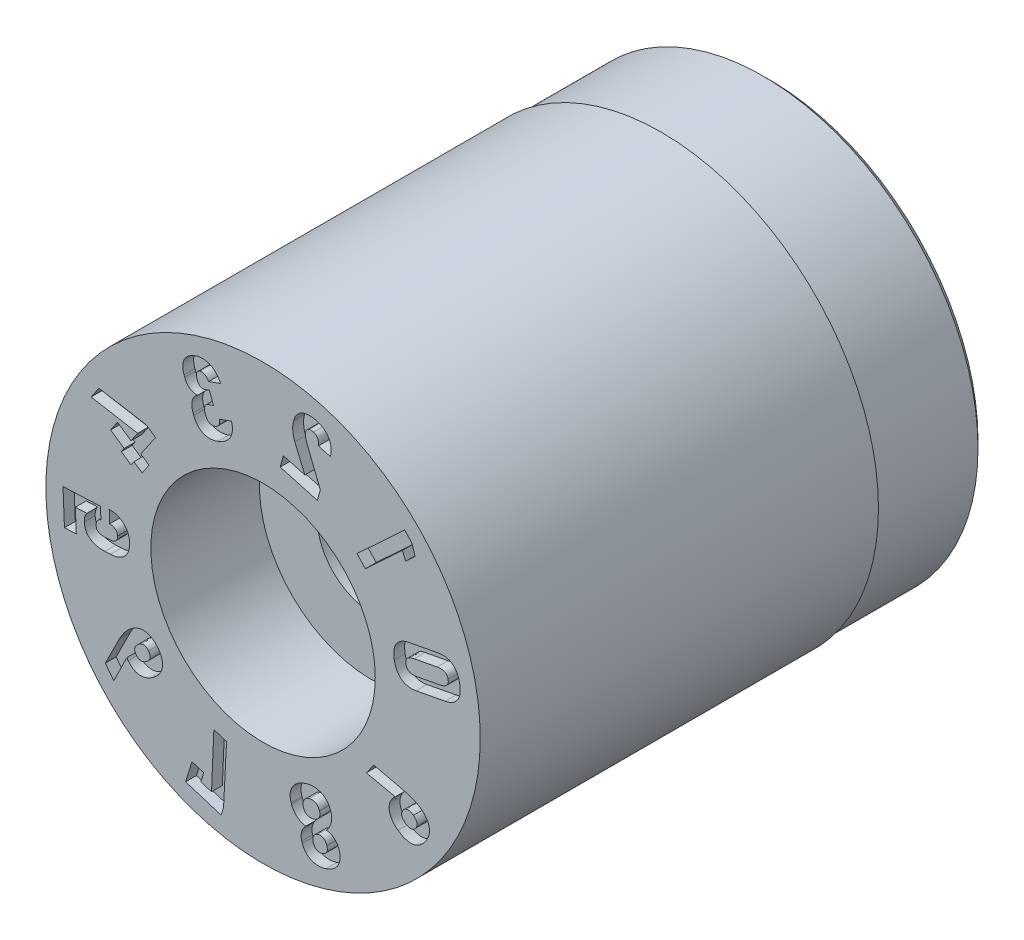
SolidWorks part; units mm, degrees
ref_plane "Front Plane" through (0, 0, 0) normal (0, 0, 1) x (1, 0, 0)
ref_plane "Top Plane" through (0, 0, 0) normal (0, 1, 0) x (1, 0, 0)
ref_plane "Right Plane" through (0, 0, 0) normal (1, 0, 0) x (0, 0, -1)
sketch "Sketch1" plane through (0, 0, 0) normal (1, 0, 0) x (0, 0, -1)
  line L2 (0, 6) -> (0, 3.1)
  line L3 (13.75, 6) -> (0, 6)
  line L4 (-3.7979, 0) -> (49996.2021, 0) construction
  line L8 (14, 1.5) -> (3, 1.5)
  line L9 (3, 3.1) -> (3, 1.5)
  line L10 (3, 3.1) -> (0, 3.1)
  line L12 (14, 1.5) -> (14, 5.75)
  line L16 (14, 5.75) -> (13.75, 6)
  dimension "D1" = 14
  dimension "D2" = 45
  dimension "D3" = 0.25
  dimension "D4" = 12
  dimension "D5" = 6.2
  dimension "D6" = 3
  dimension "D7" = 3
revolve "Revolve1" add sketch "Sketch1" angle 360 about L4
sketch "Sketch4" plane through (0, 0, 0) normal (1, 0, 0) x (0, 0, -1)
  line L0 (0, 0) -> (50000, 0) construction
  line L1 (14, -5.75) -> (14, 5.75) construction
  line L2 (11, 6.935) -> (14, 6.935)
  line L3 (11, 6.935) -> (11, 5.935)
  line L4 (11, 5.935) -> (14, 5.935)
  line L5 (14, 6.935) -> (14, 5.935)
  line L6 (13.75, 6) -> (0, 6) construction
  line L9 (0, 6.6) -> (0, -6.6) construction
  dimension "D1" = 1
  dimension "D2" = 0.065
  dimension "D3" = 11
revolve "Cut-Revolve1" cut sketch "Sketch4" angle 360 about L0
sketch "Sketch5" plane through (0, 0, 0) normal (0, 0, 1) x (1, 0, 0)
  line L0 (4.227, 0.2493) -> (5.0305, 0.4005)
  line L1 (4.8312, 1.4577) -> (4.0277, 1.3065)
  line L2 (4.1758, 0.9894) -> (4.8089, 1.1087)
  line L3 (4.8825, 0.7172) -> (4.2493, 0.5979)
  line L4 (2.5953, 2.7152) -> (2.8257, 2.4673)
  line L5 (2.8257, 2.4673) -> (3.8509, 3.42)
  line L6 (3.8509, 3.42) -> (3.9391, 3.2031)
  line L7 (3.9391, 3.2031) -> (4.2028, 3.4482)
  line L8 (4.2028, 3.4482) -> (4.1089, 3.7273)
  line L9 (4.1089, 3.7273) -> (3.9122, 3.9389)
  line L10 (3.9122, 3.9389) -> (2.5953, 2.7152)
  line L11 (1.5819, 3.7338) -> (1.2041, 4.6814)
  line L12 (1.178, 4.9162) -> (1.1787, 4.9188)
  line L13 (1.529, 4.7595) -> (1.5285, 4.7581)
  line L14 (1.5285, 4.7581) -> (1.8636, 4.665)
  line L15 (1.8636, 4.665) -> (1.864, 4.6664)
  line L16 (0.8452, 5.0216) -> (0.8448, 5.0202)
  line L17 (0.8774, 4.5321) -> (1.1544, 3.8746)
  line L18 (1.1544, 3.8746) -> (0.5618, 4.0392)
  line L19 (0.5618, 4.0392) -> (0.4744, 3.7243)
  line L20 (0.4744, 3.7243) -> (1.5, 3.4392)
  line L21 (1.5, 3.4392) -> (1.5819, 3.7338)
  line L22 (-0.8723, 4.1501) -> (-1.2031, 4.0315)
  line L23 (-1.5828, 3.928) -> (-1.5972, 3.9679)
  line L24 (-1.5146, 4.2257) -> (-1.3704, 4.2773)
  line L25 (-1.3704, 4.2773) -> (-1.4809, 4.5862)
  line L26 (-1.4809, 4.5862) -> (-1.6251, 4.5347)
  line L27 (-1.8151, 4.6643) -> (-1.8256, 4.6932)
  line L28 (-1.5024, 4.7812) -> (-1.1726, 4.8993)
  line L29 (-2.1813, 4.6032) -> (-2.1626, 4.5516)
  line L30 (-1.9324, 3.8202) -> (-1.9141, 3.7683)
  line L31 (-3.2277, 2.885) -> (-4.5347, 3.1049)
  line L32 (-4.5347, 3.1049) -> (-4.7493, 2.7892)
  line L33 (-4.7493, 2.7892) -> (-3.4629, 2.5646)
  line L34 (-3.4629, 2.5646) -> (-3.6463, 2.2946)
  line L35 (-3.9148, 1.8992) -> (-3.6458, 1.7166)
  line L36 (-3.6458, 1.7166) -> (-3.567, 1.8327)
  line L37 (-2.971, 2.7105) -> (-3.2277, 2.885)
  line L38 (-4.0215, 2.5493) -> (-4.2111, 2.27)
  line L39 (-4.2111, 2.27) -> (-3.836, 2.0154)
  line L40 (-3.3384, 1.6776) -> (-3.1489, 1.9569)
  line L41 (-3.1489, 1.9569) -> (-3.3773, 2.112)
  line L42 (-4.2484, 0.3524) -> (-4.2495, 0.3523)
  line L43 (-4.2495, 0.3523) -> (-4.2353, 0.013)
  line L44 (-4.2353, 0.013) -> (-4.2342, 0.0131)
  line L45 (-4.232, -0.3673) -> (-4.3827, -0.3738)
  line L46 (-4.4785, -0.0144) -> (-4.4917, 0.3026)
  line L47 (-4.4917, 0.3026) -> (-5.5264, 0.2595)
  line L48 (-5.5264, 0.2595) -> (-5.486, -0.7074)
  line L49 (-5.486, -0.7074) -> (-5.1592, -0.6938)
  line L50 (-5.1592, -0.6938) -> (-5.1853, -0.0662)
  line L51 (-5.1853, -0.0662) -> (-4.8673, -0.0529)
  line L52 (-4.3685, -0.7127) -> (-4.2178, -0.7062)
  line L53 (-3.6581, -2.2113) -> (-3.659, -2.2122)
  line L54 (-3.9742, -2.6184) -> (-4.3583, -3.3842)
  line L55 (-4.3583, -3.3842) -> (-4.1215, -3.6862)
  line L56 (-4.1215, -3.6862) -> (-3.7618, -2.9518)
  line L58 (-3.0133, -3.0446) -> (-3.0127, -3.044)
  line L59 (-3.2054, -2.7637) -> (-3.2064, -2.7646)
  line L60 (-3.4371, -2.4686) -> (-3.4362, -2.4681)
  line L61 (-1.0913, -5.2035) -> (-1.0082, -3.5818)
  line L62 (-1.0082, -3.5818) -> (-1.3589, -3.4725)
  line L63 (-1.3589, -3.4725) -> (-1.4238, -4.9936)
  line L64 (-1.4238, -4.9936) -> (-1.7188, -4.9018)
  line L65 (-1.7188, -4.9018) -> (-1.638, -4.6434)
  line L66 (-1.638, -4.6434) -> (-1.9616, -4.5426)
  line L67 (-1.9616, -4.5426) -> (-2.1395, -5.1129)
  line L68 (-2.1395, -5.1129) -> (-1.1585, -5.4183)
  line L69 (-1.1585, -5.4183) -> (-1.0913, -5.2035)
  line L70 (0.7762, -4.1555) -> (0.7854, -4.1838)
  line L71 (1.0695, -4.9228) -> (1.0847, -4.9678)
  line L72 (2.1023, -4.6312) -> (2.0871, -4.5862)
  line L73 (1.8742, -3.8236) -> (1.865, -3.7952)
  line L74 (1.557, -3.9496) -> (1.5624, -3.9661)
  line L75 (1.1204, -4.1113) -> (1.1144, -4.0933)
  line L76 (1.7594, -4.6803) -> (1.7649, -4.6968)
  line L77 (1.3941, -4.8183) -> (1.3883, -4.8007)
  line L79 (3.7284, -3.3377) -> (3.7295, -3.3385)
  line L80 (4.3383, -2.4856) -> (4.3377, -2.485)
  line L81 (3.8696, -2.3021) -> (3.0604, -2.1122)
  line L82 (3.0604, -2.1122) -> (2.8514, -2.4016)
  line L83 (2.8514, -2.4016) -> (3.6525, -2.5752)
  line L84 (4.1528, -2.7676) -> (4.1538, -2.7685)
  line L85 (3.9342, -3.0702) -> (3.9332, -3.0694)
  line L86 (-3.6463, 2.2946) -> (-4.0215, 2.5493)
  line L87 (-3.3773, 2.112) -> (-2.971, 2.7105)
  line L88 (-3.836, 2.0154) -> (-3.9148, 1.8992)
  line L89 (-3.567, 1.8327) -> (-3.3384, 1.6776)
  circle A0 centre (0, 0) radius 3.7731 construction
  spline S0 degree 3 poles (3.6255, 0.6832) (3.6329, 0.6425) (3.648, 0.5837) (3.6765, 0.5104) (3.7004, 0.4616) (3.7283, 0.4177) (3.7595, 0.3784) (3.7939, 0.3434) (3.8322, 0.3138) (3.8732, 0.2887) (3.9168, 0.2687) (3.9626, 0.2525) (4.0111, 0.2427) (4.0618, 0.2365) (4.1344, 0.2357) (4.1898, 0.2421) (4.227, 0.2493) knots 0 0 0 0 0.14708 0.214839 0.278938 0.340014 0.399093 0.456868 0.513928 0.570655 0.627181 0.684187 0.742494 0.802536 0.865451 1 1 1 1
  spline S1 degree 3 poles (5.0305, 0.4005) (5.0681, 0.4076) (5.1225, 0.4217) (5.1904, 0.449) (5.2356, 0.473) (5.2768, 0.5006) (5.314, 0.5316) (5.3471, 0.5665) (5.3758, 0.6049) (5.4001, 0.6468) (5.4193, 0.6917) (5.434, 0.7395) (5.4436, 0.7905) (5.4485, 0.8446) (5.4477, 0.923) (5.4403, 0.9829) (5.4327, 1.0234) knots 0 0 0 0 0.135991 0.198957 0.259278 0.317536 0.374793 0.430928 0.487677 0.544842 0.602257 0.660982 0.722058 0.786137 0.853629 1 1 1 1
  spline S2 degree 3 poles (5.4327, 1.0234) (5.4255, 1.0642) (5.41, 1.1227) (5.3824, 1.1962) (5.3582, 1.2448) (5.3308, 1.2888) (5.3, 1.3284) (5.2654, 1.363) (5.2279, 1.3933) (5.1873, 1.4184) (5.1439, 1.4387) (5.0982, 1.4546) (5.0496, 1.4647) (4.9985, 1.4702) (4.925, 1.4722) (4.869, 1.4644) (4.8312, 1.4577) knots 0 0 0 0 0.146861 0.214087 0.27809 0.338994 0.397858 0.455548 0.512086 0.568467 0.62461 0.681531 0.739751 0.800471 0.863458 1 1 1 1
  spline S3 degree 3 poles (4.0277, 1.3065) (3.9901, 1.2992) (3.9355, 1.2856) (3.868, 1.2575) (3.8227, 1.2336) (3.7815, 1.206) (3.7443, 1.175) (3.7112, 1.1402) (3.6825, 1.1017) (3.6582, 1.0599) (3.6389, 1.0149) (3.6246, 0.9668) (3.6148, 0.9158) (3.61, 0.8618) (3.6104, 0.7835) (3.618, 0.7237) (3.6255, 0.6832) knots 0 0 0 0 0.135999 0.198976 0.2593 0.317561 0.374821 0.430959 0.487712 0.54488 0.602298 0.661367 0.722447 0.78653 0.853621 1 1 1 1
  spline S4 degree 3 poles (3.9465, 0.7438) (3.9429, 0.7595) (3.9414, 0.7829) (3.9425, 0.8135) (3.9468, 0.8344) (3.953, 0.8541) (3.9615, 0.8727) (3.9731, 0.8897) (3.992, 0.9112) (4.0218, 0.9351) (4.084, 0.9675) (4.1376, 0.9823) (4.1758, 0.9894) knots 0 0 0 0 0.125716 0.183583 0.23912 0.292225 0.34507 0.398743 0.452722 0.568432 0.69579 1 1 1 1
  spline S5 degree 3 poles (4.8089, 1.1087) (4.8471, 1.1153) (4.9025, 1.1222) (4.9721, 1.1137) (5.0087, 1.1025) (5.0339, 1.0891) (5.0509, 1.0776) (5.0659, 1.0635) (5.0787, 1.0473) (5.0903, 1.0294) (5.1031, 1.0017) (5.1093, 0.9789) (5.1121, 0.963) knots 0 0 0 0 0.30425 0.431921 0.546902 0.601209 0.654314 0.707409 0.761607 0.816243 0.873811 1 1 1 1
  spline S6 degree 3 poles (5.1121, 0.963) (5.1157, 0.9473) (5.1172, 0.9238) (5.1161, 0.8933) (5.1118, 0.8724) (5.1057, 0.8525) (5.0967, 0.8342) (5.0855, 0.8168) (5.0662, 0.7957) (5.0365, 0.7716) (4.9746, 0.7384) (4.9204, 0.7249) (4.8825, 0.7172) knots 0 0 0 0 0.125602 0.183416 0.238903 0.29196 0.345455 0.398296 0.453077 0.568682 0.696043 1 1 1 1
  spline S7 degree 3 poles (4.2493, 0.5979) (4.2113, 0.5905) (4.1558, 0.5846) (4.0862, 0.5929) (4.0495, 0.6041) (4.0245, 0.6175) (4.0074, 0.6289) (3.9929, 0.6433) (3.9798, 0.6593) (3.9684, 0.6773) (3.9555, 0.7051) (3.9494, 0.7279) (3.9465, 0.7438) knots 0 0 0 0 0.30444 0.432146 0.547158 0.60148 0.654599 0.707302 0.760602 0.816192 0.873776 1 1 1 1
  spline S8 degree 3 poles (1.2041, 4.6814) (1.1882, 4.7216) (1.1734, 4.7736) (1.1692, 4.8363) (1.1693, 4.873) (1.1732, 4.8995) (1.178, 4.9162) knots 0 0 0 0 0.541521 0.666579 0.783721 1 1 1 1
  spline S9 degree 3 poles (1.1787, 4.9188) (1.1847, 4.9397) (1.1978, 4.9699) (1.2279, 4.9997) (1.2542, 5.0153) (1.2842, 5.0255) (1.3318, 5.03) (1.3688, 5.0237) (1.3937, 5.0165) knots 0 0 0 0 0.245859 0.357439 0.46891 0.585493 0.709548 1 1 1 1
  spline S10 degree 3 poles (1.3937, 5.0165) (1.4184, 5.0093) (1.4542, 4.9937) (1.4908, 4.9584) (1.5113, 4.927) (1.5263, 4.8912) (1.5363, 4.8346) (1.5346, 4.7899) (1.529, 4.7595) knots 0 0 0 0 0.240985 0.354134 0.468631 0.5874 0.713052 1 1 1 1
  spline S11 degree 3 poles (1.864, 4.6664) (1.8752, 4.7183) (1.8836, 4.7957) (1.8785, 4.8969) (1.8651, 4.9667) (1.8441, 5.0323) (1.8146, 5.0928) (1.7773, 5.148) (1.7318, 5.1971) (1.6795, 5.2408) (1.599, 5.2917) (1.5306, 5.3175) (1.4833, 5.3309) knots 0 0 0 0 0.185674 0.271386 0.354246 0.434158 0.512263 0.589164 0.666877 0.746222 0.827244 1 1 1 1
  spline S12 degree 3 poles (1.4833, 5.3309) (1.4329, 5.3448) (1.358, 5.3603) (1.2595, 5.3627) (1.1922, 5.3567) (1.1296, 5.342) (1.0714, 5.3201) (1.0192, 5.2888) (0.9719, 5.2502) (0.9306, 5.2037) (0.882, 5.1299) (0.8579, 5.066) (0.8452, 5.0216) knots 0 0 0 0 0.194818 0.28296 0.366323 0.445889 0.521879 0.596881 0.671801 0.748279 0.827605 1 1 1 1
  spline S13 degree 3 poles (0.8448, 5.0202) (0.8337, 4.9808) (0.8231, 4.92) (0.818, 4.8373) (0.8202, 4.7743) (0.8273, 4.7117) (0.8421, 4.6296) (0.8618, 4.5704) (0.8774, 4.5321) knots 0 0 0 0 0.246012 0.370926 0.498251 0.625433 0.750687 1 1 1 1
  spline S14 degree 3 poles (-1.2468, 3.4786) (-1.1978, 3.4957) (-1.1283, 3.5284) (-1.0452, 3.5845) (-0.9914, 3.6314) (-0.9454, 3.6834) (-0.9073, 3.7399) (-0.8781, 3.8009) (-0.8572, 3.8656) (-0.8459, 3.9338) (-0.8437, 4.0301) (-0.858, 4.1025) (-0.8723, 4.1501) knots 0 0 0 0 0.181189 0.266469 0.349309 0.42972 0.508169 0.586269 0.664997 0.744856 0.826563 1 1 1 1
  spline S15 degree 3 poles (-1.2031, 4.0315) (-1.1987, 4.0142) (-1.1967, 3.9882) (-1.1973, 3.9543) (-1.2013, 3.9307) (-1.2078, 3.9085) (-1.2172, 3.8879) (-1.2291, 3.8691) (-1.2431, 3.8519) (-1.2595, 3.8363) (-1.2859, 3.8186) (-1.3072, 3.807) (-1.3231, 3.8019) knots 0 0 0 0 0.186458 0.271753 0.355242 0.435515 0.513981 0.590927 0.668033 0.74632 0.827255 1 1 1 1
  spline S16 degree 3 poles (-1.3231, 3.8019) (-1.3504, 3.7924) (-1.3922, 3.7827) (-1.4467, 3.7886) (-1.4828, 3.8011) (-1.5151, 3.8217) (-1.5534, 3.8618) (-1.573, 3.9002) (-1.5828, 3.928) knots 0 0 0 0 0.266172 0.383198 0.497107 0.612379 0.730215 1 1 1 1
  spline S17 degree 3 poles (-1.5972, 3.9679) (-1.6076, 3.9967) (-1.6188, 4.0395) (-1.619, 4.0954) (-1.6121, 4.1314) (-1.5978, 4.1631) (-1.5692, 4.2005) (-1.5367, 4.2173) (-1.5146, 4.2257) knots 0 0 0 0 0.300024 0.427576 0.545016 0.655861 0.765085 1 1 1 1
  spline S18 degree 3 poles (-1.6251, 4.5347) (-1.6434, 4.5279) (-1.6728, 4.5236) (-1.7108, 4.5322) (-1.7366, 4.5466) (-1.7603, 4.5671) (-1.7909, 4.6045) (-1.8061, 4.6396) (-1.8151, 4.6643) knots 0 0 0 0 0.226284 0.333189 0.444788 0.564052 0.694141 1 1 1 1
  spline S19 degree 3 poles (-1.8256, 4.6932) (-1.8335, 4.7167) (-1.843, 4.7518) (-1.841, 4.7978) (-1.8332, 4.8276) (-1.8194, 4.854) (-1.7927, 4.8857) (-1.7636, 4.8998) (-1.7439, 4.9075) knots 0 0 0 0 0.287753 0.411591 0.527861 0.639744 0.752927 1 1 1 1
  spline S20 degree 3 poles (-1.7439, 4.9075) (-1.7301, 4.9125) (-1.7084, 4.9176) (-1.6789, 4.9169) (-1.6569, 4.914) (-1.6352, 4.907) (-1.6138, 4.8981) (-1.5932, 4.8856) (-1.5731, 4.8705) (-1.554, 4.8521) (-1.5284, 4.8237) (-1.5128, 4.7984) (-1.5024, 4.7812) knots 0 0 0 0 0.148721 0.221348 0.296414 0.371996 0.449759 0.529719 0.614659 0.702909 0.796697 1 1 1 1
  spline S21 degree 3 poles (-1.1726, 4.8993) (-1.1948, 4.9467) (-1.2329, 5.0141) (-1.2985, 5.0905) (-1.3507, 5.1391) (-1.4078, 5.1783) (-1.4673, 5.2104) (-1.5304, 5.2323) (-1.5957, 5.2464) (-1.6628, 5.2517) (-1.7548, 5.246) (-1.8229, 5.2303) (-1.8669, 5.2138) knots 0 0 0 0 0.185937 0.272263 0.356354 0.437912 0.517414 0.595439 0.674146 0.75359 0.833658 1 1 1 1
  spline S22 degree 3 poles (-1.8669, 5.2138) (-1.9027, 5.2012) (-1.9536, 5.1793) (-2.016, 5.1434) (-2.0569, 5.1147) (-2.0935, 5.0833) (-2.1255, 5.0496) (-2.1529, 5.0131) (-2.1757, 4.9745) (-2.1938, 4.9338) (-2.2073, 4.8914) (-2.215, 4.847) (-2.2186, 4.8012) (-2.2168, 4.7539) (-2.2073, 4.6868) (-2.1929, 4.6368) (-2.1813, 4.6032) knots 0 0 0 0 0.145511 0.212086 0.276075 0.337093 0.396693 0.454167 0.511617 0.568277 0.624892 0.682152 0.740565 0.800818 0.863592 1 1 1 1
  spline S23 degree 3 poles (-2.1626, 4.5516) (-2.1493, 4.5144) (-2.1233, 4.4612) (-2.0728, 4.4026) (-2.0303, 4.3655) (-1.9822, 4.3363) (-1.9108, 4.3066) (-1.8523, 4.2979) (-1.8128, 4.2969) knots 0 0 0 0 0.257245 0.378725 0.500357 0.621364 0.74282 1 1 1 1
  spline S24 degree 3 poles (-1.8128, 4.2969) (-1.8309, 4.2853) (-1.8566, 4.266) (-1.886, 4.2358) (-1.9058, 4.2123) (-1.9222, 4.1866) (-1.9367, 4.1596) (-1.9478, 4.1306) (-1.9572, 4.1004) (-1.9635, 4.0687) (-1.9677, 4.0361) (-1.9683, 4.0022) (-1.9669, 3.9676) (-1.9624, 3.932) (-1.9527, 3.8822) (-1.9414, 3.845) (-1.9324, 3.8202) knots 0 0 0 0 0.120839 0.17875 0.236021 0.292822 0.349349 0.407341 0.466659 0.526612 0.588188 0.650868 0.71599 0.78255 0.851867 1 1 1 1
  spline S25 degree 3 poles (-1.9141, 3.7683) (-1.8971, 3.7225) (-1.8672, 3.6569) (-1.8117, 3.5818) (-1.766, 3.5354) (-1.7155, 3.4968) (-1.6599, 3.4673) (-1.5998, 3.4468) (-1.5356, 3.4352) (-1.4677, 3.4325) (-1.3694, 3.4407) (-1.296, 3.4616) (-1.2468, 3.4786) knots 0 0 0 0 0.177849 0.259155 0.337577 0.413781 0.488775 0.564884 0.643293 0.724994 0.81079 1 1 1 1
  spline S26 degree 3 poles (-3.6876, -0.1525) (-3.6897, -0.1064) (-3.6993, -0.0378) (-3.7307, 0.0473) (-3.7608, 0.1063) (-3.7988, 0.16) (-3.844, 0.2081) (-3.8967, 0.2496) (-3.9556, 0.2855) (-4.0212, 0.3137) (-4.1181, 0.343) (-4.1957, 0.3507) (-4.2484, 0.3524) knots 0 0 0 0 0.165245 0.244424 0.322863 0.400913 0.478529 0.557552 0.63942 0.724147 0.811331 1 1 1 1
  spline S27 degree 3 poles (-4.2342, 0.0131) (-4.204, 0.0113) (-4.1605, 0.0041) (-4.1086, -0.0182) (-4.0769, -0.0398) (-4.0511, -0.0663) (-4.025, -0.1086) (-4.0176, -0.146) (-4.0166, -0.1711) knots 0 0 0 0 0.286677 0.413247 0.532744 0.64808 0.761103 1 1 1 1
  spline S28 degree 3 poles (-4.0166, -0.1711) (-4.0162, -0.1977) (-4.0192, -0.2383) (-4.0438, -0.2843) (-4.0685, -0.3131) (-4.1004, -0.3361) (-4.1544, -0.3594) (-4.2002, -0.3659) (-4.232, -0.3673) knots 0 0 0 0 0.244619 0.356445 0.468733 0.585859 0.710532 1 1 1 1
  spline S29 degree 3 poles (-4.3827, -0.3738) (-4.4143, -0.3749) (-4.4602, -0.3734) (-4.5156, -0.3561) (-4.549, -0.3383) (-4.5757, -0.3147) (-4.6032, -0.2759) (-4.6099, -0.2397) (-4.6114, -0.2159) knots 0 0 0 0 0.303265 0.432107 0.550999 0.662525 0.769301 1 1 1 1
  spline S30 degree 3 poles (-4.6114, -0.2159) (-4.6127, -0.1931) (-4.6095, -0.1594) (-4.5953, -0.1175) (-4.5803, -0.0896) (-4.5606, -0.065) (-4.5288, -0.036) (-4.4991, -0.0216) (-4.4785, -0.0144) knots 0 0 0 0 0.262806 0.385849 0.507006 0.626637 0.74726 1 1 1 1
  spline S31 degree 3 poles (-4.8673, -0.0529) (-4.88, -0.0669) (-4.8954, -0.0918) (-4.9121, -0.1285) (-4.9328, -0.1915) (-4.9395, -0.2477) (-4.9378, -0.2924) knots 0 0 0 0 0.220738 0.342483 0.474 1 1 1 1
  spline S32 degree 3 poles (-4.9378, -0.2924) (-4.9362, -0.3361) (-4.9267, -0.4003) (-4.8954, -0.4786) (-4.8649, -0.5304) (-4.8266, -0.5764) (-4.7807, -0.6156) (-4.7281, -0.6489) (-4.6683, -0.6752) (-4.602, -0.695) (-4.5017, -0.713) (-4.4227, -0.715) (-4.3685, -0.7127) knots 0 0 0 0 0.163691 0.239767 0.314001 0.387834 0.462201 0.538928 0.619759 0.705773 0.797169 1 1 1 1
  spline S33 degree 3 poles (-4.2178, -0.7062) (-4.1636, -0.7039) (-4.0844, -0.6947) (-3.9865, -0.6633) (-3.9221, -0.6333) (-3.8647, -0.5963) (-3.8148, -0.5519) (-3.7731, -0.5004) (-3.7389, -0.4426) (-3.7127, -0.3785) (-3.6888, -0.2818) (-3.6856, -0.2049) (-3.6876, -0.1525) knots 0 0 0 0 0.187028 0.272197 0.353058 0.431044 0.506489 0.581821 0.658218 0.737109 0.819387 1 1 1 1
  spline S34 degree 3 poles (-2.9056, -2.2896) (-2.9376, -2.2491) (-2.9893, -2.1933) (-3.0695, -2.1365) (-3.13, -2.1043) (-3.1926, -2.0819) (-3.2571, -2.0699) (-3.323, -2.0683) (-3.3899, -2.0769) (-3.4575, -2.0954) (-3.5507, -2.1352) (-3.6159, -2.1787) (-3.6581, -2.2113) knots 0 0 0 0 0.180298 0.262844 0.341996 0.418743 0.493946 0.569924 0.647567 0.728532 0.813597 1 1 1 1
  spline S35 degree 3 poles (-3.659, -2.2122) (-3.6853, -2.2332) (-3.7241, -2.267) (-3.772, -2.3174) (-3.8456, -2.4026) (-3.899, -2.4817) (-3.937, -2.5482) knots 0 0 0 0 0.230207 0.350844 0.475765 1 1 1 1
  spline S36 degree 3 poles (-3.937, -2.5482) (-3.9438, -2.5596) (-3.9566, -2.5829) (-3.9688, -2.6064) (-3.9742, -2.6184) knots 0 0 0 0 0.502807 1 1 1 1
  spline S37 degree 3 poles (-3.7618, -2.9518) (-3.7519, -2.9714) (-3.7394, -2.9897) (-3.7262, -3.007) knots 0.759339 0.759339 0.759339 0.759339 1 1 1 1
  spline S38 degree 3 poles (-3.7262, -3.007) (-3.6977, -3.0434) (-3.6504, -3.0928) (-3.577, -3.1423) (-3.5206, -3.1693) (-3.4618, -3.1868) (-3.4009, -3.1947) (-3.3384, -3.1931) (-3.2744, -3.182) (-3.2096, -3.1612) (-3.1188, -3.1203) (-3.0547, -3.0773) (-3.0133, -3.0446) knots 0 0 0 0 0.171399 0.250433 0.326678 0.401893 0.476561 0.552972 0.632426 0.716098 0.804457 1 1 1 1
  spline S39 degree 3 poles (-3.0127, -3.044) (-2.9705, -3.0104) (-2.9121, -2.9569) (-2.8508, -2.8749) (-2.8161, -2.8132) (-2.7913, -2.7497) (-2.7762, -2.6849) (-2.7726, -2.6191) (-2.7789, -2.5527) (-2.7954, -2.486) (-2.8319, -2.3943) (-2.8736, -2.3304) (-2.9056, -2.2896) knots 0 0 0 0 0.187278 0.272314 0.353593 0.431766 0.507592 0.582942 0.659159 0.737967 0.819996 1 1 1 1
  spline S40 degree 3 poles (-3.1624, -2.4914) (-3.1461, -2.5126) (-3.125, -2.5469) (-3.1154, -2.5974) (-3.1169, -2.6336) (-3.1269, -2.669) (-3.1522, -2.7166) (-3.183, -2.7457) (-3.2054, -2.7637) knots 0 0 0 0 0.258674 0.374449 0.487863 0.602639 0.723306 1 1 1 1
  spline S41 degree 3 poles (-3.2064, -2.7646) (-3.2327, -2.7845) (-3.2727, -2.8116) (-3.331, -2.8293) (-3.371, -2.8337) (-3.4093, -2.8287) (-3.4583, -2.8092) (-3.488, -2.7811) (-3.5047, -2.7599) knots 0 0 0 0 0.294267 0.420156 0.537435 0.648669 0.759224 1 1 1 1
  spline S42 degree 3 poles (-3.5047, -2.7599) (-3.5219, -2.7389) (-3.5406, -2.7029) (-3.5481, -2.6508) (-3.5434, -2.6123) (-3.5294, -2.5742) (-3.4981, -2.5219) (-3.4627, -2.4892) (-3.4371, -2.4686) knots 0 0 0 0 0.240463 0.349973 0.462516 0.580198 0.707082 1 1 1 1
  spline S43 degree 3 poles (-3.4362, -2.4681) (-3.4134, -2.4506) (-3.3778, -2.428) (-3.3258, -2.4143) (-3.2892, -2.4133) (-3.2537, -2.4203) (-3.2073, -2.4421) (-3.1791, -2.4705) (-3.1624, -2.4914) knots 0 0 0 0 0.277302 0.39705 0.512682 0.625485 0.741527 1 1 1 1
  spline S44 degree 3 poles (1.1628, -3.4985) (1.1115, -3.5157) (1.0381, -3.5468) (0.9512, -3.6035) (0.8957, -3.6508) (0.8477, -3.7025) (0.8091, -3.7588) (0.7793, -3.8188) (0.7594, -3.8823) (0.7481, -3.9485) (0.747, -4.0411) (0.7612, -4.1104) (0.7762, -4.1555) knots 0 0 0 0 0.189267 0.277092 0.361956 0.443821 0.522942 0.599835 0.677345 0.755081 0.833779 1 1 1 1
  spline S45 degree 3 poles (0.7854, -4.1838) (0.7992, -4.2261) (0.8295, -4.2862) (0.8854, -4.3568) (0.9357, -4.4036) (0.9913, -4.444) (1.0717, -4.4867) (1.1375, -4.5055) (1.1824, -4.5113) knots 0 0 0 0 0.245704 0.369763 0.497088 0.625016 0.749576 1 1 1 1
  spline S46 degree 3 poles (1.1824, -4.5113) (1.1547, -4.5381) (1.1181, -4.5835) (1.0838, -4.6523) (1.0651, -4.7063) (1.0537, -4.7615) (1.049, -4.8346) (1.0584, -4.8887) (1.0695, -4.9228) knots 0 0 0 0 0.257544 0.384667 0.512219 0.638321 0.760057 1 1 1 1
  spline S47 degree 3 poles (1.0847, -4.9678) (1.0993, -5.01) (1.126, -5.0715) (1.1798, -5.1406) (1.225, -5.185) (1.2758, -5.2222) (1.3321, -5.2505) (1.3925, -5.2722) (1.4575, -5.2843) (1.5256, -5.2894) (1.6223, -5.2831) (1.6946, -5.2664) (1.7425, -5.2504) knots 0 0 0 0 0.166991 0.24621 0.324565 0.402312 0.479469 0.558504 0.640353 0.724932 0.812049 1 1 1 1
  spline S48 degree 3 poles (1.7425, -5.2504) (1.7905, -5.2346) (1.8588, -5.2051) (1.9401, -5.1521) (1.992, -5.1075) (2.0366, -5.0587) (2.0724, -5.0057) (2.1003, -4.9492) (2.119, -4.8892) (2.1291, -4.8267) (2.1298, -4.7393) (2.1163, -4.6738) (2.1023, -4.6312) knots 0 0 0 0 0.187873 0.275417 0.360294 0.441981 0.520587 0.597953 0.675533 0.753757 0.832693 1 1 1 1
  spline S49 degree 3 poles (2.0871, -4.5862) (2.0753, -4.5518) (2.0509, -4.5018) (2.0024, -4.4457) (1.9599, -4.4081) (1.9121, -4.3762) (1.8428, -4.3426) (1.7863, -4.3285) (1.748, -4.3241) knots 0 0 0 0 0.24189 0.363901 0.48997 0.617557 0.743887 1 1 1 1
  spline S50 degree 3 poles (1.748, -4.3241) (1.7802, -4.2919) (1.8228, -4.2376) (1.8623, -4.155) (1.8836, -4.0895) (1.8965, -4.0221) (1.8995, -3.9321) (1.8889, -3.8657) (1.8742, -3.8236) knots 0 0 0 0 0.251847 0.376945 0.504402 0.631555 0.754572 1 1 1 1
  spline S51 degree 3 poles (1.865, -3.7952) (1.8503, -3.7499) (1.8201, -3.686) (1.7645, -3.612) (1.716, -3.5656) (1.6616, -3.527) (1.6019, -3.4964) (1.5372, -3.4747) (1.4679, -3.4615) (1.3951, -3.4569) (1.2915, -3.4627) (1.214, -3.4815) (1.1628, -3.4985) knots 0 0 0 0 0.166424 0.244685 0.32272 0.400073 0.477336 0.556337 0.63806 0.723313 0.810962 1 1 1 1
  spline S52 degree 3 poles (1.2658, -3.8099) (1.2864, -3.8032) (1.3178, -3.7961) (1.3598, -3.7952) (1.3897, -3.7978) (1.4183, -3.8048) (1.4453, -3.8149) (1.4702, -3.8293) (1.4931, -3.8471) (1.5133, -3.8684) (1.5379, -3.901) (1.5502, -3.9298) (1.557, -3.9496) knots 0 0 0 0 0.179375 0.263495 0.346504 0.426861 0.505925 0.584222 0.663909 0.744388 0.82625 1 1 1 1
  spline S53 degree 3 poles (1.5624, -3.9661) (1.5686, -3.9844) (1.574, -4.0125) (1.5739, -4.0501) (1.569, -4.0769) (1.5604, -4.1027) (1.5485, -4.1272) (1.5326, -4.1498) (1.514, -4.1713) (1.4912, -4.1901) (1.4566, -4.2137) (1.4265, -4.2257) (1.4059, -4.2328) knots 0 0 0 0 0.166558 0.244876 0.323273 0.400576 0.478937 0.557042 0.639017 0.723619 0.811325 1 1 1 1
  spline S54 degree 3 poles (1.4059, -4.2328) (1.385, -4.2394) (1.3537, -4.2476) (1.3118, -4.2496) (1.2823, -4.2478) (1.2543, -4.2421) (1.2281, -4.2328) (1.2035, -4.2208) (1.1817, -4.2043) (1.1614, -4.1856) (1.1388, -4.1554) (1.126, -4.1298) (1.1204, -4.1113) knots 0 0 0 0 0.188608 0.275831 0.360139 0.442071 0.520836 0.598448 0.676628 0.755653 0.834544 1 1 1 1
  spline S55 degree 3 poles (1.1144, -4.0933) (1.108, -4.0736) (1.1011, -4.0434) (1.1014, -4.0029) (1.1054, -3.9739) (1.1132, -3.9461) (1.1245, -3.92) (1.1403, -3.8959) (1.1592, -3.8737) (1.1814, -3.8535) (1.2161, -3.83) (1.2451, -3.8165) (1.2658, -3.8099) knots 0 0 0 0 0.17305 0.254327 0.335508 0.415168 0.493423 0.571546 0.652873 0.735566 0.819946 1 1 1 1
  spline S56 degree 3 poles (1.5096, -4.5469) (1.5269, -4.5408) (1.5537, -4.5354) (1.5895, -4.5347) (1.615, -4.5384) (1.6394, -4.5449) (1.6623, -4.5554) (1.6837, -4.5687) (1.7035, -4.5854) (1.7208, -4.6053) (1.7417, -4.636) (1.7532, -4.662) (1.7594, -4.6803) knots 0 0 0 0 0.172756 0.255121 0.335642 0.414327 0.492081 0.57111 0.651459 0.734559 0.818594 1 1 1 1
  spline S57 degree 3 poles (1.7649, -4.6968) (1.7702, -4.714) (1.7763, -4.7401) (1.7769, -4.7749) (1.7742, -4.7995) (1.7679, -4.823) (1.7581, -4.845) (1.7457, -4.8658) (1.7298, -4.8849) (1.7111, -4.9019) (1.682, -4.9224) (1.6568, -4.9328) (1.6395, -4.9389) knots 0 0 0 0 0.176555 0.258727 0.338978 0.418046 0.49506 0.573776 0.653706 0.736518 0.820135 1 1 1 1
  spline S58 degree 3 poles (1.6395, -4.9389) (1.622, -4.9444) (1.5955, -4.9513) (1.56, -4.9514) (1.5348, -4.9494) (1.5108, -4.9434) (1.4882, -4.9343) (1.4676, -4.9218) (1.4484, -4.9067) (1.4312, -4.8883) (1.4107, -4.8599) (1.3995, -4.8355) (1.3941, -4.8183) knots 0 0 0 0 0.179385 0.263016 0.344819 0.425188 0.503219 0.580639 0.659511 0.741063 0.824446 1 1 1 1
  spline S59 degree 3 poles (1.3883, -4.8007) (1.3825, -4.7827) (1.376, -4.7554) (1.3749, -4.7189) (1.3774, -4.6929) (1.3831, -4.668) (1.392, -4.6445) (1.4045, -4.6229) (1.4202, -4.6032) (1.4382, -4.5848) (1.4674, -4.5643) (1.492, -4.5526) (1.5096, -4.5469) knots 0 0 0 0 0.179804 0.263111 0.346021 0.426638 0.504807 0.583217 0.662539 0.743381 0.825713 1 1 1 1
  spline S60 degree 3 poles (3.6525, -2.5752) (3.6513, -2.5761) (3.6404, -2.5844) (3.6105, -2.6114) (3.5849, -2.6406) (3.5696, -2.6624) knots 0.564869 0.564869 0.564869 0.564869 0.581683 0.712593 1 1 1 1
  spline S61 degree 3 poles (3.5696, -2.6624) (3.544, -2.6969) (3.5137, -2.7532) (3.4894, -2.8333) (3.4815, -2.8937) (3.4819, -2.9542) (3.4918, -3.0144) (3.5102, -3.0739) (3.5378, -3.132) (3.5734, -3.1884) (3.6333, -3.2616) (3.6888, -3.3086) (3.7284, -3.3377) knots 0 0 0 0 0.165095 0.243502 0.320908 0.3984 0.475565 0.554589 0.637017 0.722339 0.810468 1 1 1 1
  spline S62 degree 3 poles (3.7295, -3.3385) (3.7734, -3.3697) (3.8405, -3.4115) (3.9361, -3.4471) (4.0046, -3.4637) (4.0721, -3.47) (4.1381, -3.4665) (4.2021, -3.4522) (4.264, -3.4283) (4.3232, -3.3941) (4.4009, -3.334) (4.4505, -3.2764) (4.4808, -3.2346) knots 0 0 0 0 0.18773 0.272775 0.35413 0.432059 0.507805 0.583072 0.659321 0.737917 0.819994 1 1 1 1
  spline S63 degree 3 poles (4.4808, -3.2346) (4.5111, -3.193) (4.5493, -3.1278) (4.5819, -3.0354) (4.5952, -2.9681) (4.5983, -2.9015) (4.5906, -2.8359) (4.5735, -2.7717) (4.5455, -2.7092) (4.508, -2.6489) (4.4428, -2.5693) (4.3824, -2.5174) (4.3383, -2.4856) knots 0 0 0 0 0.17814 0.259721 0.338422 0.414965 0.48981 0.566169 0.644476 0.725942 0.811607 1 1 1 1
  spline S64 degree 3 poles (4.3377, -2.485) (4.3125, -2.4662) (4.271, -2.4421) (4.2127, -2.4123) (4.1644, -2.3917) (4.1128, -2.3727) (4.0384, -2.3467) (3.98, -2.3307) (3.9403, -2.3197) knots 0 0 0 0 0.217345 0.332435 0.453733 0.580961 0.714056 1 1 1 1
  spline S65 degree 3 poles (3.9403, -2.3197) (3.9283, -2.3166) (3.9051, -2.3095) (3.8813, -2.3043) (3.8696, -2.3021) knots 0 0 0 0 0.508015 1 1 1 1
  spline S66 degree 3 poles (3.8663, -2.7902) (3.8817, -2.7683) (3.9101, -2.7401) (3.9567, -2.7178) (3.9935, -2.7106) (4.0321, -2.7123) (4.0882, -2.7265) (4.1274, -2.7497) (4.1528, -2.7676) knots 0 0 0 0 0.246904 0.359132 0.471361 0.587799 0.712697 1 1 1 1
  spline S67 degree 3 poles (4.1538, -2.7685) (4.1779, -2.7863) (4.2111, -2.8153) (4.2403, -2.863) (4.2531, -2.8985) (4.2568, -2.9351) (4.2501, -2.986) (4.2309, -3.0211) (4.2156, -3.0428) knots 0 0 0 0 0.283484 0.406123 0.522197 0.635112 0.748685 1 1 1 1
  spline S68 degree 3 poles (4.2156, -3.0428) (4.2, -3.0648) (4.1719, -3.0933) (4.1255, -3.1162) (4.0894, -3.1235) (4.0514, -3.123) (3.9968, -3.1098) (3.9587, -3.0877) (3.9342, -3.0702) knots 0 0 0 0 0.252807 0.36584 0.478595 0.594664 0.717809 1 1 1 1
  spline S69 degree 3 poles (3.9332, -3.0694) (3.9085, -3.0506) (3.8732, -3.0216) (3.8432, -2.9723) (3.8297, -2.9362) (3.8254, -2.8991) (3.8316, -2.8476) (3.8503, -2.8118) (3.8663, -2.7902) knots 0 0 0 0 0.287594 0.411199 0.527112 0.639624 0.751346 1 1 1 1
  dimension "D1" = 7.5461
extrude "Cut-Extrude1" cut sketch "Sketch5" against normal blind 0.3
